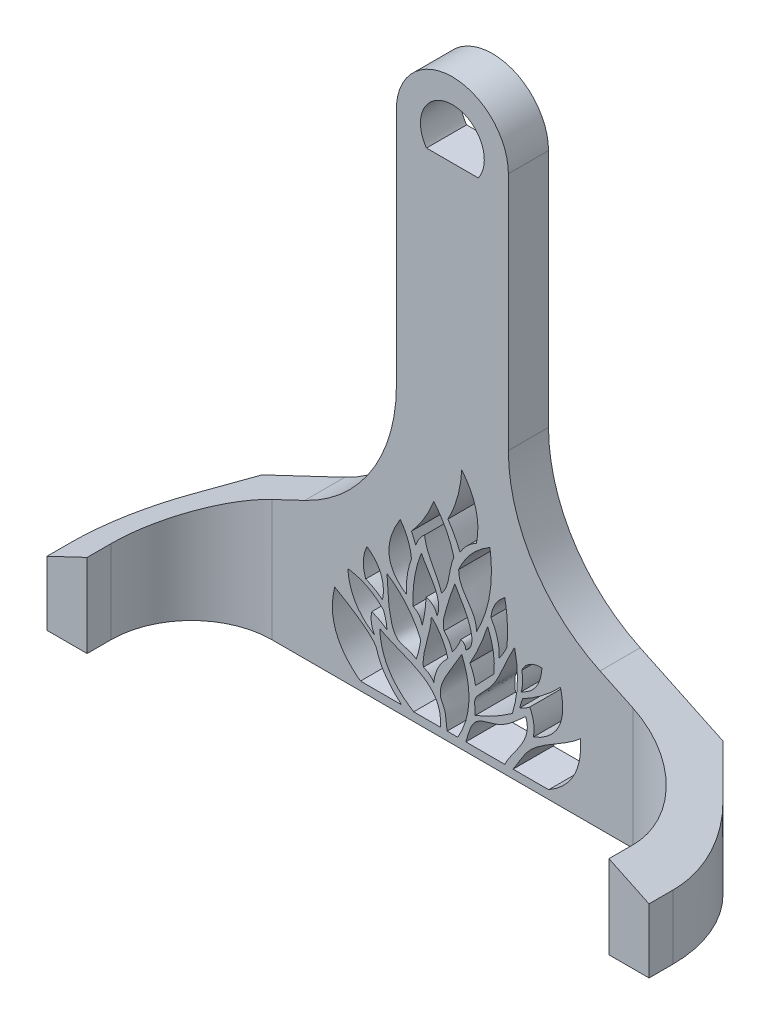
SolidWorks part; units mm, degrees
ref_plane "Front Plane" through (0, 0, 0) normal (0, 0, 1) x (1, 0, 0)
ref_plane "Top Plane" through (0, 0, 0) normal (0, 1, 0) x (1, 0, 0)
ref_plane "Right Plane" through (0, 0, 0) normal (1, 0, 0) x (0, 0, -1)
sketch "Sketch1" plane through (0, 0, 0) normal (0, 0, 1) x (1, 0, 0)
  line L0 (-75, 0) -> (75, 0)
  line L1 (-13.95, 130) -> (-13.95, 70.2827)
  line L2 (-36.7871, 34.1519) -> (-75, 16)
  line L3 (-75, 16) -> (-75, 0)
  line L4 (0, 0) -> (0, 130) construction
  line L5 (13.95, 130) -> (13.95, 70.2827)
  line L6 (36.7871, 34.1519) -> (75, 16)
  line L7 (75, 16) -> (75, 0)
  line L8 (6.4483, 125.35) -> (-6.4483, 125.35)
  arc A0 (6.4483, 125.35) -> (-6.4483, 125.35) centre (0, 130) ccw
  arc A1 (13.95, 130) -> (-13.95, 130) centre (0, 130) ccw
  arc A2 (13.95, 70.2827) -> (36.7871, 34.1519) centre (53.95, 70.2827) ccw
  arc A3 (-13.95, 70.2827) -> (-36.7871, 34.1519) centre (-53.95, 70.2827) cw
  point P4 (0, 0)
  point P16 (13.95, 45)
  point P19 (-13.95, 45)
  point P22 (75, 16)
  point P25 (-75, 16)
  dimension "D2" = 15.9
  dimension "D4" = 6
  dimension "D7" = 40
  dimension "D8" = 4.65
  dimension "D1" = 150
  dimension "D3" = 130
  dimension "D5" = 45
  dimension "D6" = 16
extrude "Boss-Extrude1" add sketch "Sketch1" along normal blind 10
sketch "Sketch3" plane through (0, 0, 10) normal (0, 0, 1) x (1, 0, 0)
  line L15 (-65, 20.7502) -> (-65, 0)
  line L16 (0, 0) -> (0, 25.6237) construction
  line L17 (65, 20.7502) -> (65, 0)
  line L18 (65, 0) -> (75, 0)
  line L20 (75, 16) -> (36.7871, 34.1519)
  line L21 (75, 0) -> (75, 16)
  line L22 (-36.7871, 34.1519) -> (-75, 16)
  line L23 (-75, 16) -> (-75, 0)
  line L24 (-75, 0) -> (75, 0)
  line L25 (75, 16) -> (65, 20.7502)
  line L26 (75, 0) -> (75, 16)
  line L27 (-65, 20.7502) -> (-75, 16)
  line L28 (-75, 16) -> (-75, 0)
  line L29 (-75, 0) -> (-65, 0)
  dimension "D2" = 10
  dimension "D1" = 0
extrude "Boss-Extrude3" add sketch "Sketch3" along normal blind 26
fillet "Fillet1" radius 20 2 edges at (65, 10.3751, 10) (-65, 10.3751, 10)
sketch "Sketch4" plane through (0, 0, 0) normal (0, -1, 0) x (1, 0, 0)
  line L0 (57.4264, 0) -> (66.2132, 8.7868)
  line L1 (-75, 0) -> (75, 0) construction
  line L3 (75, 36) -> (75, 0) construction
  line L4 (57.4264, 0) -> (75, 0)
  line L5 (75, 0) -> (75, 30)
  line L6 (0, 0) -> (0, 22.0643) construction
  line L7 (-57.4264, 0) -> (-66.2132, 8.7868)
  line L8 (-57.4264, 0) -> (-75, 0)
  line L9 (-75, 0) -> (-75, 30)
  arc A0 (66.2132, 8.7868) -> (75, 30) centre (45, 30) ccw
  arc A1 (-66.2132, 8.7868) -> (-75, 30) centre (-45, 30) cw
  point P0 (45, 30)
  dimension "D1" = 135
extrude "Cut-Extrude1" cut sketch "Sketch4" against normal through all
sketch "Sketch6" plane through (0, 0, 10) normal (0, 0, 1) x (1, 0, 0)
  line L0 (68.7535, 286.3057) -> (424.7535, 286.3057) construction
  line L1 (-9.6357, 2.1188) -> (-3.0093, 2.1188)
  line L3 (-1.304, 2.1188) -> (1.3514, 2.1188)
  line L5 (3.349, 2.1188) -> (13.0537, 2.1188)
  line L6 (15.1216, 2.1188) -> (23.9931, 2.1188)
  line L7 (-12.6879, 2.1188) -> (-22.8984, 2.1188)
  spline S0 degree 3 poles (3.349, 2.1188) (3.8846, 3.7853) (5.0035, 8.7019) (12.1649, 9.253) (15.5453, 12.6333) (18.2444, 15.0193) knots 0 0 0 0 0.218875 0.53549 1 1 1 1
  spline S1 degree 3 poles (13.0537, 2.1188) (14.7043, 5.9127) (20.2273, 10.2654) (18.2444, 15.0193) knots 0 0 0 0 1 1 1 1
  spline S2 degree 2 poles (1.3514, 2.1188) (6.3644, 10.8131) (2.3341, 20.5004) knots 0 0 0 1 1 1
  spline S3 degree 3 poles (-1.304, 2.1188) (-1.5571, 3.4939) (-1.5335, 6.4569) (-3.1041, 8.3494) (-2.8519, 12.6792) (-0.747, 15.0642) (2.3341, 20.5004) knots 0 0 0 0 0.160123 0.338694 0.422682 1 1 1 1
  spline S4 degree 3 poles (-3.0093, 2.1188) (-2.1074, 11.4741) (-12.0853, 12.5221) (-18.0973, 15.8513) knots 0 0 0 0 1 1 1 1
  spline S5 degree 2 poles (-18.0973, 15.8513) (-17.8034, 7.2049) (-9.6357, 2.1188) knots 0 0 0 1 1 1
  spline S6 degree 2 poles (5.6901, 8.9943) (10.625, 10.9591) (14.946, 14.0506) knots 0 0 0 1 1 1
  spline S7 degree 2 poles (14.946, 14.0506) (17.1643, 21.1394) (15.504, 28.6138) knots 0 0 0 1 1 1
  spline S8 degree 3 poles (5.6901, 8.9943) (5.6263, 11.1854) (5.0281, 12.7853) (11.6866, 18.4829) (12.3213, 22.7698) (15.504, 28.6138) knots 0 0 0 0 0.190455 0.437917 1 1 1 1
  spline S9 degree 2 poles (-9.0033, 13.8277) (-8.1822, 16.1049) (-7.8924, 18.5139) knots 0 0 0 1 1 1
  spline S10 degree 3 poles (-9.0033, 13.8277) (-10.1567, 14.4901) (-11.1024, 14.8512) (-14.6559, 15.6262) (-15.9725, 22.8625) (-15.8333, 21.3808) (-16.2964, 28.6138) knots 0 0 0 0 0.147969 0.261475 0.535784 1 1 1 1
  spline S11 degree 2 poles (-7.8924, 18.5139) (-10.4989, 24.812) (-16.2964, 28.6138) knots 0 0 0 1 1 1
  spline S12 degree 2 poles (-4.6329, 10.9606) (-4.1668, 15.019) (-1.1161, 17.8745) knots 0 0 0 1 1 1
  spline S13 degree 2 poles (-4.6329, 10.9606) (-5.5593, 12.4215) (-7.2405, 12.9352) knots 0 0 0 1 1 1
  spline S14 degree 3 poles (-7.2405, 12.9352) (-7.5587, 17.0444) (-5.371, 20.7478) (-5.236, 24.8125) knots 0 0 0 0 1 1 1 1
  spline S15 degree 2 poles (-1.1161, 17.8745) (-2.1595, 21.9179) (-5.236, 24.8125) knots 0 0 0 1 1 1
  spline S16 degree 2 poles (-7.5401, 21.7131) (-6.6787, 24.9918) (-6.5599, 28.3921) knots 0 0 0 1 1 1
  spline S17 degree 2 poles (-6.5599, 28.3921) (-4.3581, 27.9164) (-3.8314, 25.6839) knots 0 0 0 1 1 1
  spline S18 degree 2 poles (-7.5401, 21.7131) (-7.8309, 23.814) (-9.7499, 24.8125) knots 0 0 0 1 1 1
  spline S19 degree 2 poles (-9.7499, 24.8125) (-10.154, 31.235) (-7.7229, 37.3141) knots 0 0 0 1 1 1
  spline S20 degree 3 poles (-7.7229, 37.3141) (-6.0986, 33.9389) (-2.0756, 29.8853) (-3.8314, 25.6839) knots 0 0 0 0 1 1 1 1
  spline S21 degree 2 poles (0, 19.819) (1.3427, 21.5516) (2.1129, 23.6071) knots 0 0 0 1 1 1
  spline S22 degree 2 poles (2.1129, 23.6071) (3.2243, 23.2893) (3.349, 21.929) knots 0 0 0 1 1 1
  spline S23 degree 3 poles (3.349, 21.929) (6.0097, 23.6188) (3.4554, 30.2234) (2.4451, 31.6778) (0.6176, 34.8552) knots 0 0 0 0 0.567372 1 1 1 1
  spline S24 degree 3 poles (0.6176, 34.8552) (-0.5033, 32.1161) (-1.13, 29.3232) (-2.6217, 25.0757) (-2.0407, 23.3911) knots 0 0 0 0 0.561677 1 1 1 1
  spline S25 degree 2 poles (0, 19.819) (-0.5996, 21.838) (-2.0407, 23.3911) knots 0 0 0 1 1 1
  spline S26 degree 2 poles (5.7706, 15.4675) (5.437, 17.6746) (4.3725, 19.6364) knots 0 0 0 1 1 1
  spline S27 degree 2 poles (5.7706, 15.4675) (8.0569, 17.9087) (10.3912, 20.3041) knots 0 0 0 1 1 1
  spline S28 degree 2 poles (10.3912, 20.3041) (10.7723, 25.2099) (8.7857, 29.7494) knots 0 0 0 1 1 1
  spline S29 degree 2 poles (4.3725, 19.6364) (7.0828, 24.4638) (8.7857, 29.7494) knots 0 0 0 1 1 1
  spline S30 degree 3 poles (-12.6879, 2.1188) (-15.3789, 4.4036) (-18.7809, 9.2558) (-18.4623, 12.773) (-26.9827, 17.9141) (-29.3193, 19.2117) knots 0 0 0 0 0.258366 0.490885 1 1 1 1
  spline S31 degree 2 poles (-29.3193, 19.2117) (-31.923, 8.8417) (-22.8984, 2.1188) knots 0 0 0 1 1 1
  spline S32 degree 3 poles (15.1216, 2.1188) (17.0831, 5.1245) (19.6424, 10.5314) (28.6716, 14.0373) (31.8772, 17.0674) knots 0 0 0 0 0.346729 1 1 1 1
  spline S33 degree 2 poles (31.8772, 17.0674) (32.647, 7.1734) (23.9931, 2.1188) knots 0 0 0 1 1 1
  spline S34 degree 2 poles (20.1687, 11.5567) (20.7723, 14.6891) (19.2941, 17.6171) knots 0 0 0 1 1 1
  spline S35 degree 2 poles (19.2941, 17.6171) (18.1559, 16.6966) (16.7895, 16.1605) knots 0 0 0 1 1 1
  spline S36 degree 2 poles (16.7895, 16.1605) (17.0285, 17.3766) (17.5174, 18.5139) knots 0 0 0 1 1 1
  spline S37 degree 2 poles (20.1687, 11.5567) (29.5081, 15.4184) (26.9192, 25.6839) knots 0 0 0 1 1 1
  spline S38 degree 2 poles (17.5174, 18.5139) (22.7863, 21.3536) (26.9192, 25.6839) knots 0 0 0 1 1 1
  spline S39 degree 2 poles (-19.4112, 13.8277) (-20.6266, 16.0568) (-20.0769, 18.5139) knots 0 0 0 1 1 1
  spline S40 degree 2 poles (-20.0769, 18.5139) (-18.04, 17.7691) (-16.2964, 16.4708) knots 0 0 0 1 1 1
  spline S41 degree 2 poles (-16.2964, 16.4708) (-16.4082, 18.4515) (-17.1531, 20.3041) knots 0 0 0 1 1 1
  spline S42 degree 2 poles (-19.4112, 13.8277) (-25.4931, 17.5275) (-26.0696, 24.8125) knots 0 0 0 1 1 1
  spline S43 degree 2 poles (-26.0696, 24.8125) (-20.8096, 24.1549) (-17.1531, 20.3041) knots 0 0 0 1 1 1
  spline S44 degree 2 poles (-17.4003, 22.3704) (-19.3127, 23.9022) (-21.5738, 24.8125) knots 0 0 0 1 1 1
  spline S45 degree 2 poles (-17.4003, 22.3704) (-16.2846, 28.3248) (-21.2792, 31.9862) knots 0 0 0 1 1 1
  spline S46 degree 2 poles (-21.5738, 24.8125) (-22.9294, 28.3882) (-21.2792, 31.9862) knots 0 0 0 1 1 1
  spline S47 degree 2 poles (-11.4795, 26.5801) (-19.283, 31.747) (-13.0025, 41.9722) knots 0 0 0 1 1 1
  spline S48 degree 2 poles (-11.4795, 26.5801) (-11.6774, 30.8296) (-10.1758, 34.8552) knots 0 0 0 1 1 1
  spline S49 degree 2 poles (-10.1758, 34.8552) (-10.6322, 38.8218) (-13.0025, 41.9722) knots 0 0 0 1 1 1
  spline S50 degree 2 poles (17.128, 19.819) (21.981, 21.8528) (22.3014, 27.5614) knots 0 0 0 1 1 1
  spline S51 degree 2 poles (17.128, 19.819) (17.818, 22.1725) (17.2877, 24.5545) knots 0 0 0 1 1 1
  spline S52 degree 2 poles (17.2877, 24.5545) (18.7668, 27.5975) (22.3014, 27.5614) knots 0 0 0 1 1 1
  spline S53 degree 2 poles (11.6581, 24.3559) (12.8415, 25.9188) (13.6119, 27.7208) knots 0 0 0 1 1 1
  spline S54 degree 2 poles (11.6581, 24.3559) (11.8453, 28.4743) (9.6013, 32.1046) knots 0 0 0 1 1 1
  spline S55 degree 2 poles (13.6119, 27.7208) (14.0935, 32.9158) (13.0537, 38.0933) knots 0 0 0 1 1 1
  spline S56 degree 2 poles (9.6013, 32.1046) (10.0156, 35.8395) (13.0537, 38.0933) knots 0 0 0 1 1 1
  spline S57 degree 2 poles (5.9892, 27.16) (10.8955, 36.3767) (9.3616, 47.0882) knots 0 0 0 1 1 1
  spline S58 degree 3 poles (5.9892, 27.16) (6.1511, 31.6679) (1.4095, 33.9612) (1.581, 38.448) knots 0 0 0 0 1 1 1 1
  spline S59 degree 2 poles (1.581, 38.448) (4.0291, 43.9933) (9.3616, 47.0882) knots 0 0 0 1 1 1
  spline S60 degree 3 poles (-2.6737, 31.1911) (-0.9595, 33.1929) (-0.8689, 36.6904) (0.0596, 39.7344) (0.367, 40.4698) knots 0 0 0 0 0.49516 0.657508 0.657508 0.657508 0.657508
  spline S61 degree 3 poles (-2.6737, 31.1911) (-3.804, 34.8042) (-6.5105, 37.7303) (-6.9255, 41.6164) knots 0 0 0 0 1 1 1 1
  spline S62 degree 2 poles (-6.9255, 41.6164) (-8.5149, 40.2806) (-9.1076, 38.3061) knots 0 0 0 1 1 1
  spline S63 degree 2 poles (1.8927, 42.2871) (3.3889, 44.8573) (5.9892, 46.2828) knots 0 0 0 1 1 1
  spline S64 degree 2 poles (-9.1076, 38.3061) (-9.6012, 39.5846) (-10.1758, 40.8278) knots 0 0 0 1 1 1
  spline S65 degree 2 poles (-10.1758, 40.8278) (-6.6354, 44.9145) (-4.6329, 49.9596) knots 0 0 0 1 1 1
  spline S66 degree 2 poles (0.367, 40.4698) (-1.016, 45.7968) (-4.6329, 49.9596) knots 0 0 0 1 1 1
  spline S67 degree 2 poles (1.8927, 42.2871) (0.6989, 45.295) (-1.1161, 47.9526) knots 0 0 0 1 1 1
  spline S68 degree 2 poles (5.9892, 46.2828) (7.5691, 53.8225) (2.3341, 60.3211) knots 0 0 0 1 1 1
  spline S69 degree 2 poles (-1.1161, 47.9526) (1.9608, 53.7042) (2.3341, 60.3211) knots 0 0 0 1 1 1
extrude "Cut-Extrude3" cut sketch "Sketch6" against normal through all both and the other way through all
